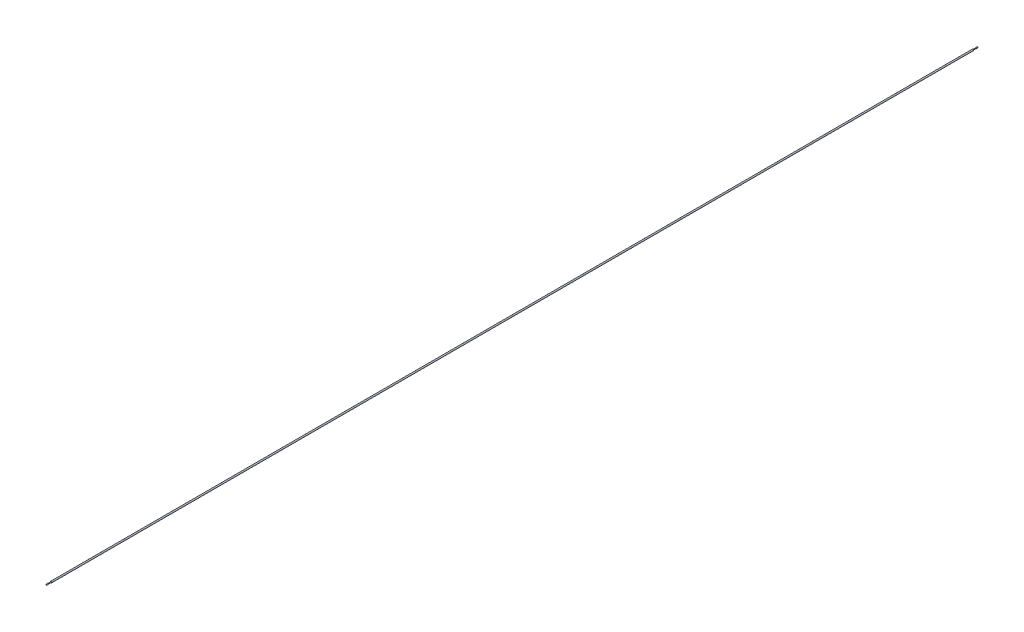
SolidWorks part; units mm, degrees
ref_plane "Front Plane" through (0, 0, 0) normal (0, 0, 1) x (1, 0, 0)
ref_plane "Top Plane" through (0, 0, 0) normal (0, 1, 0) x (1, 0, 0)
ref_plane "Right Plane" through (0, 0, 0) normal (1, 0, 0) x (0, 0, -1)
sketch "Sketch1" plane through (0, 0, 0) normal (0, 0, 1) x (1, 0, 0)
  circle A0 centre (0, 0) radius 3.175
  circle A1 centre (0, 0) radius 2.413
  dimension "D1" = 6.35
  dimension "D2" = 0.762
extrude "Boss-Extrude1" add sketch "Sketch1" along normal mid plane 4267.2
sketch "Sketch2" plane through (0, 0, 2133.6) normal (0, 0, 1) x (1, 0, 0)
  circle A0 centre (0, 0) radius 3.175
extrude "Boss-Extrude2" add sketch "Sketch2" along normal blind 3.81
sketch "Sketch3" plane through (0, 0, 2137.41) normal (0, 0, 1) x (1, 0, 0)
  circle A0 centre (0, 0) radius 1.5875
  dimension "D1" = 3.175
extrude "Boss-Extrude3" add sketch "Sketch3" along normal blind 12.7
sketch "Sketch4" plane through (0, 0, 2150.11) normal (0, 0, 1) x (1, 0, 0)
  circle A0 centre (0, 0) radius 2.3495
  dimension "D1" = 4.699
extrude "Boss-Extrude4" add sketch "Sketch4" along normal blind 8.89
chamfer "Chamfer1" distance 0.635 angle 45 2 edges at (2.3495, 0, 2150.11) (2.3495, 0, 2159)
mirror "Mirror3" about plane through (0, 0, 0) normal (0, 0, 1) of "Boss-Extrude4", "Boss-Extrude3", "Boss-Extrude2"
chamfer "Chamfer2" distance 0.635 angle 45 2 edges at (2.3495, 0, -2159) (2.3495, 0, -2150.11)
